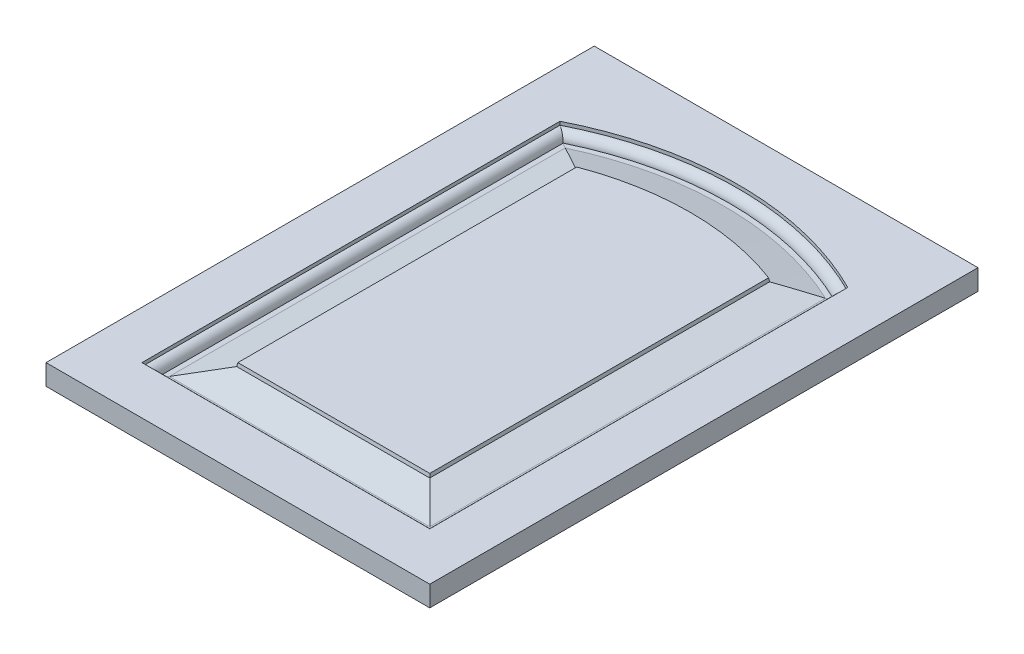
SolidWorks part; units mm, degrees
ref_plane "Front Plane" through (0, 0, 0) normal (0, 0, 1) x (1, 0, 0)
ref_plane "Top Plane" through (0, 0, 0) normal (0, 1, 0) x (1, 0, 0)
ref_plane "Right Plane" through (0, 0, 0) normal (1, 0, 0) x (0, 0, -1)
sketch "Sketch1" plane through (0, 0, 0) normal (0, 1, 0) x (1, 0, 0)
  line L1 (-177.8, 0) -> (177.8, 0)
  line L2 (-177.8, 0) -> (-177.8, 508)
  line L3 (-177.8, 508) -> (177.8, 508)
  line L4 (177.8, 0) -> (177.8, 508)
  dimension "D1" = 355.6
  dimension "D2" = 508
extrude "Boss-Extrude1" add sketch "Sketch1" along normal blind 19.05
sketch "Path" plane through (0, 19.05, 0) normal (0, 1, 0) x (1, 0, 0)
  line L5 (177.8, 508) -> (-177.8, 508) construction
  line L9 (-133.35, 463.55) -> (-133.35, 44.45)
  line L10 (-133.35, 44.45) -> (133.35, 44.45)
  line L11 (133.35, 44.45) -> (133.35, 463.55)
  line L14 (133.35, 463.55) -> (-133.35, 463.55)
  line L16 (-133.35, 431.8) -> (-133.35, 44.45)
  line L17 (-133.35, 44.45) -> (133.35, 44.45)
  line L18 (133.35, 44.45) -> (133.35, 431.8)
  arc A1 (-133.35, 431.8) -> (133.35, 431.8) centre (0, 167.64) cw
  dimension "D2" = 76.2
  dimension "D3" = 44.45
  dimension "D1" = 44.45
ref_plane "Profile Plane" through (-133.35, 19.05, -44.45) normal (0, 0, 1) x (1, 0, 0)
sketch "Profile" plane through (125.7969, 12.1622, -44.45) normal (0, 0, 1) x (-1, 0, 0)
  line L0 (-7.5531, -6.8878) -> (-7.5531, -3.7128)
  line L3 (0.3844, 4.2247) -> (5.1469, 4.2247)
  line L4 (5.1469, 4.2247) -> (36.337, -3.7128)
  line L5 (36.337, -3.7128) -> (36.8969, -6.8878)
  line L6 (36.8969, -6.8878) -> (-7.5531, -6.8878)
  line L7 (36.8969, -6.8878) -> (36.8969, -14.8253) construction
  arc A0 (-7.5531, -3.7128) -> (0.3844, 4.2247) centre (-7.5531, 4.2247) ccw
  dimension "D2" = 7.9375
  dimension "D1" = 3.175
  dimension "D3" = 3.175
  dimension "D4" = 4.7625
  dimension "D5" = 44.45
  dimension "D6" = 10
sweep "Cut-Sweep1" cut profiles "Profile" path "Path"
